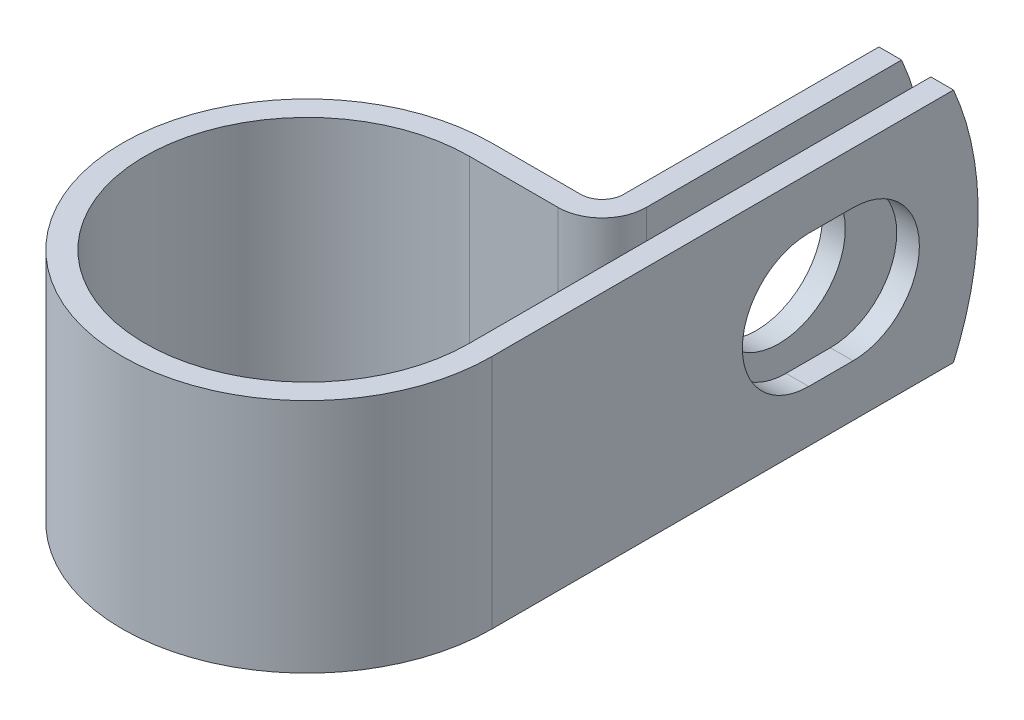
SolidWorks part; units mm, degrees
ref_plane "Front Plane" through (0, 0, 0) normal (0, 0, 1) x (1, 0, 0)
ref_plane "Top Plane" through (0, 0, 0) normal (0, 1, 0) x (1, 0, 0)
ref_plane "Right Plane" through (0, 0, 0) normal (1, 0, 0) x (0, 0, -1)
sketch "Sketch1" plane through (0, 0, 0) normal (0, 1, 0) x (1, 0, 0)
  line L0 (0, 8.7249) -> (4.7727, 8.7249)
  line L1 (8.7249, 0) -> (8.7249, 8.7249)
  line L2 (7.1501, 26.162) -> (7.1501, 11.1023)
  line L5 (8.7249, 8.7249) -> (8.7249, 26.162)
  arc A0 (0, 8.7249) -> (8.7249, 0) centre (0, 0) ccw
  arc A3 (4.7727, 8.7249) -> (7.1501, 11.1023) centre (4.7727, 11.1023) ccw
extrude "Extrude-Thin1" add sketch "Sketch1" along normal mid plane 12.7 thin
sketch "Sketch2" plane through (5.9309, 0, 0) normal (-1, 0, 0) x (0, 0, 1)
  line L0 (-26.162, 6.35) -> (-26.162, -6.35) construction
  line L7 (0, 6.35) -> (0, -6.35) construction
  circle A0 centre (-18.2372, 0) radius 3.5687
  point P2 (-26.162, 0)
extrude "Cut-Extrude1" cut sketch "Sketch2" against normal up to surface (1.2192 mm away)
sketch "Sketch3" plane through (9.9441, 0, 0) normal (1, 0, 0) x (0, 0, -1)
  line L0 (17.0434, 0) -> (19.431, 0) construction
  line L1 (17.0434, 3.5687) -> (19.431, 3.5687)
  line L2 (17.0434, -3.5687) -> (19.431, -3.5687)
  line L3 (26.162, 6.35) -> (26.162, -6.35) construction
  arc A0 (17.0434, 3.5687) -> (17.0434, -3.5687) centre (17.0434, 0) ccw
  arc A1 (19.431, -3.5687) -> (19.431, 3.5687) centre (19.431, 0) ccw
  point P3 (18.2372, 0)
  point P8 (26.162, 0)
  point P11 (13.4747, 0)
  point P12 (22.9997, 0)
extrude "Cut-Extrude2" cut sketch "Sketch3" against normal up to surface (1.2192 mm away)
sketch "Sketch4" plane through (5.9309, 0, 0) normal (-1, 0, 0) x (0, 0, 1)
  line L0 (-26.162, 6.35) -> (-26.162, -6.35)
  line L1 (-26.162, 6.35) -> (-24.8367, 6.35)
  line L2 (-26.162, 6.35) -> (-11.1023, 6.35) construction
  line L3 (-26.162, -6.35) -> (-24.8367, -6.35)
  line L4 (-26.162, -6.35) -> (-11.1023, -6.35) construction
  arc A0 (-24.8367, 6.35) -> (-24.8367, -6.35) centre (-10.287, 0) ccw
extrude "Cut-Extrude3" cut sketch "Sketch4" against normal through all contours A0 M4 M5 | A0 L0 M2
equation "\"D1@Sketch3\" = \"D2@Sketch2\""
equation "\"D7@Sketch1\" = \"D3@Sketch2\" + \"D1@Sketch3\""
equation "\"D1@Sketch4\" = ( \"D1@Extrude-Thin1\" + .125 ) * 2"
equation "\"D2@Sketch1\"=1.95*\"D5@Extrude-Thin1\""
equation "\"D2@Sketch3\" = \"D1@Sketch2\""
